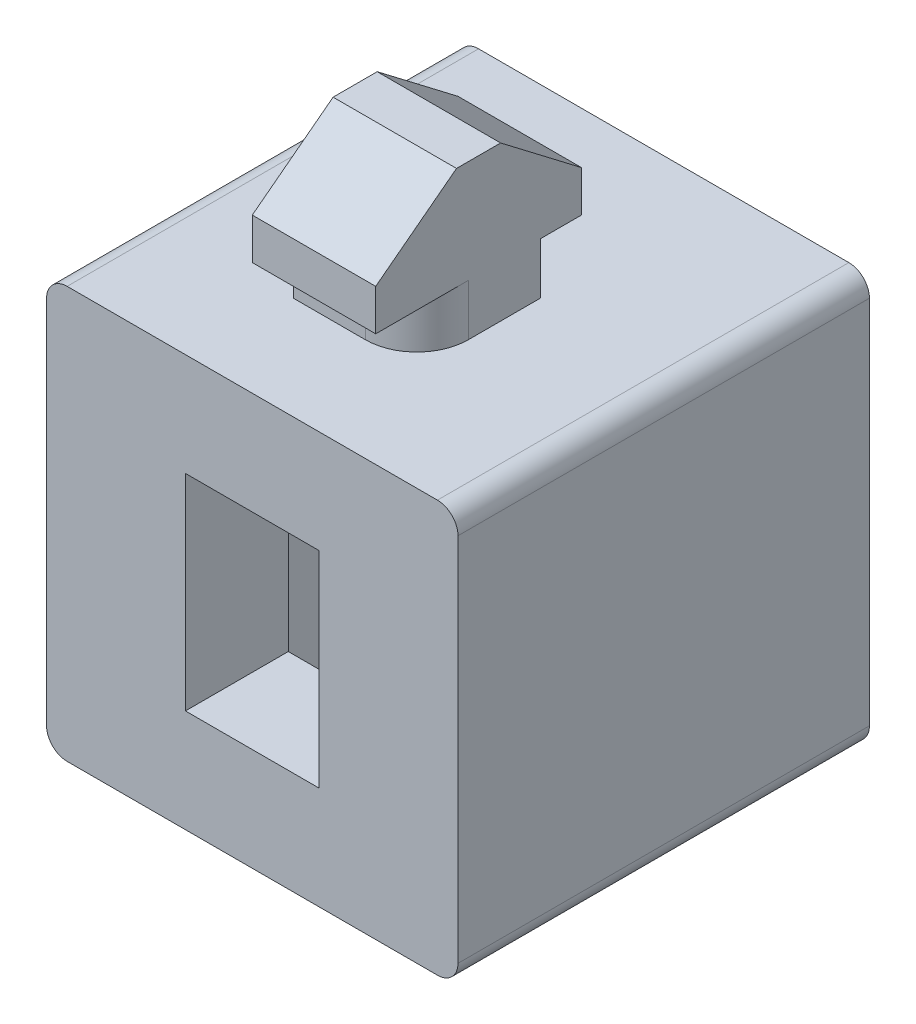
SolidWorks part; units mm, degrees
ref_plane "前视基准面" through (0, 0, 0) normal (0, 0, 1) x (1, 0, 0)
ref_plane "上视基准面" through (0, 0, 0) normal (0, 1, 0) x (1, 0, 0)
ref_plane "右视基准面" through (0, 0, 0) normal (1, 0, 0) x (0, 0, -1)
sketch "草图1" plane through (0, 0, 0) normal (0, 0, 1) x (1, 0, 0)
  line L1 (-10, 10) -> (10, 10)
  line L2 (-10, 10) -> (-10, -10)
  line L3 (-10, -10) -> (10, -10)
  line L4 (10, 10) -> (10, -10)
  line L5 (-3.25, 5) -> (3.25, 5)
  line L6 (-3.25, 5) -> (-3.25, -5)
  line L7 (-3.25, -5) -> (3.25, -5)
  line L8 (3.25, 5) -> (3.25, -5)
  dimension "D1" = 20
  dimension "D2" = 20
  dimension "D3" = 10
  dimension "D4" = 6.5
  dimension "D5" = 3.25
  dimension "D6" = 10
  dimension "D7" = 5
extrude "凸台-拉伸1" add sketch "草图1" along normal mid plane 20
sketch "草图2" plane through (0, -10, 0) normal (0, -1, 0) x (1, 0, 0)
  line L0 (-10, 10) -> (-10, -10) construction
  line L1 (-5, 5) -> (5, 5)
  line L2 (-5, 5) -> (-5, 0)
  line L3 (-5, 0) -> (5, 0)
  line L4 (5, 5) -> (5, 0)
  line L5 (-10, 10) -> (10, 10) construction
  dimension "D1" = 5
  dimension "D2" = 10
  dimension "D3" = 5
  dimension "D4" = 5
extrude "切除-拉伸1" cut sketch "草图2" against normal blind 17
sketch "草图3" plane through (0, 10, 0) normal (0, 1, 0) x (1, 0, 0)
  line L1 (-3, 1) -> (3, 1)
  line L2 (-3, 1) -> (-3, -5)
  line L3 (-3, -5) -> (3, -5)
  line L4 (3, 1) -> (3, -5)
  line L5 (-10, -10) -> (-10, 10) construction
  line L6 (10, -10) -> (-10, -10) construction
  dimension "D1" = 6
  dimension "D2" = 6
  dimension "D3" = 5
  dimension "D4" = 7
extrude "凸台-拉伸2" add sketch "草图3" along normal blind 2.5
fillet "圆角1" radius 2.5 2 edges at (-3, 11.25, -1) (3, 11.25, 5)
sketch "草图4" plane through (0, 0, 0) normal (1, 0, 0) x (0, 0, -1)
  line L0 (-2, 12.5) -> (3, 12.5)
  line L1 (-2.5, 12.5) -> (1, 12.5) construction
  line L2 (-5, 10) -> (-5, 12.5) construction
  line L3 (-0.9283, 17.5) -> (-2, 17.5)
  line L4 (-2, 12.5) -> (-2, 17.5)
  line L5 (3, 12.5) -> (3, 14.5)
  line L6 (3, 14.5) -> (-0.9283, 17.5)
  dimension "D1" = 5
  dimension "D2" = 5
  dimension "D3" = 3
  dimension "D4" = 2
extrude "凸台-拉伸3" add sketch "草图4" along normal mid plane 6
mirror "镜向1" about plane through (3, 12.5, 2) normal (0, 0, -1) of "凸台-拉伸3"
fillet "圆角2" radius 1 4 edges at (10, 10, 0) (-10, 10, 0) (-10, -10, 0) (10, -10, 0)
